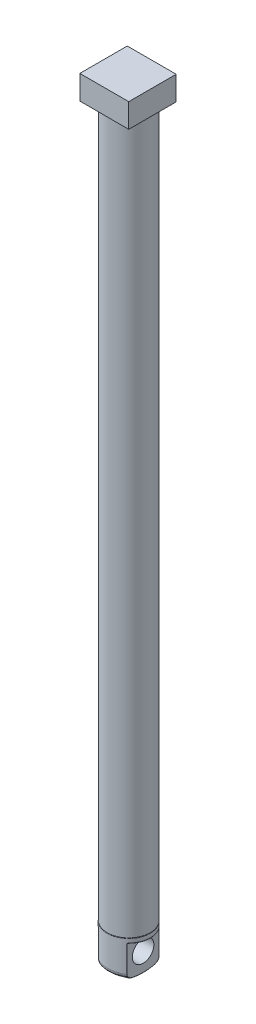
SolidWorks part; units mm, degrees
ref_plane "Plan de face" through (0, 0, 0) normal (0, 0, 1) x (1, 0, 0)
ref_plane "Plan de dessus" through (0, 0, 0) normal (0, 1, 0) x (1, 0, 0)
ref_plane "Plan de droite" through (0, 0, 0) normal (1, 0, 0) x (0, 0, -1)
imported_body "Importée3"
ref_plane "Plan1" through (0, -1, 0) normal (0, -1, 0) x (1, 0, 0)
sketch "Esquisse1" plane through (0, -1, 0) normal (0, -1, 0) x (1, 0, 0)
  circle A0 centre (10, -11.5) radius 4.475
extrude "Boss.-Extru.1" add sketch "Esquisse1" against normal blind 148
sketch "Esquisse2" plane through (0, 147, 0) normal (0, 1, 0) x (-1, 0, 0)
  line L0 (-5.525, -16.3) -> (-15.1, -16.3)
  line L1 (-15.1, -16.3) -> (-15.1, -6.4)
  line L2 (-15.1, -6.4) -> (-5.525, -6.4)
  line L3 (-5.525, -6.4) -> (-5.525, -16.3)
extrude "Boss.-Extru.2" add sketch "Esquisse2" along normal blind 5
sketch "Esquisse3" plane through (5.525, 0, 0) normal (-1, 0, 0) x (0, 0, 1)
  line L0 (-16.3, 147) -> (-16.3, 152)
  line L1 (-16.3, 152) -> (-6.4, 152)
  line L2 (-6.4, 152) -> (-6.4, 147)
  line L3 (-6.4, 147) -> (-16.3, 147)
extrude "Boss.-Extru.3" add sketch "Esquisse3" along normal blind 0.625
hole_wizard "Diamètre du perçage Ø4.5 (4.5)1" positions "Esquisse5" profile "Esquisse4" hole size "Ø4.5" standard "Ansi Metric"
sketch "Esquisse5" plane through (13, 0, 0) normal (1, 0, 0) x (0, 0, -1)
  point P0 (11.5, -5)
sketch "Esquisse4" plane through (13, -5, -11.5) normal (0, 1, 0) x (0, 0, -1)
  line L0 (0, 0) -> (0, 8.1)
  line L1 (0, 8.1) -> (2.25, 8.1)
  line L2 (2.25, 8.1) -> (2.25, 0)
  line L5 (2.25, 0) -> (0, 0)
  line L11 (0, -6.35) -> (0, 107.95) construction
  dimension "Diamètre du perçage jusqu'au prochain" = 4.5
  dimension "Profondeur du perçage jusqu'au prochain" = 8.1
ref_plane "Plan2HTigeVérin" through (0, 0, -11.5) normal (0, 0, -1) x (-1, 0, 0)
ref_plane "Plan3VTigeVérin" through (10, 0, 0) normal (1, 0, 0) x (0, -1, 0)
